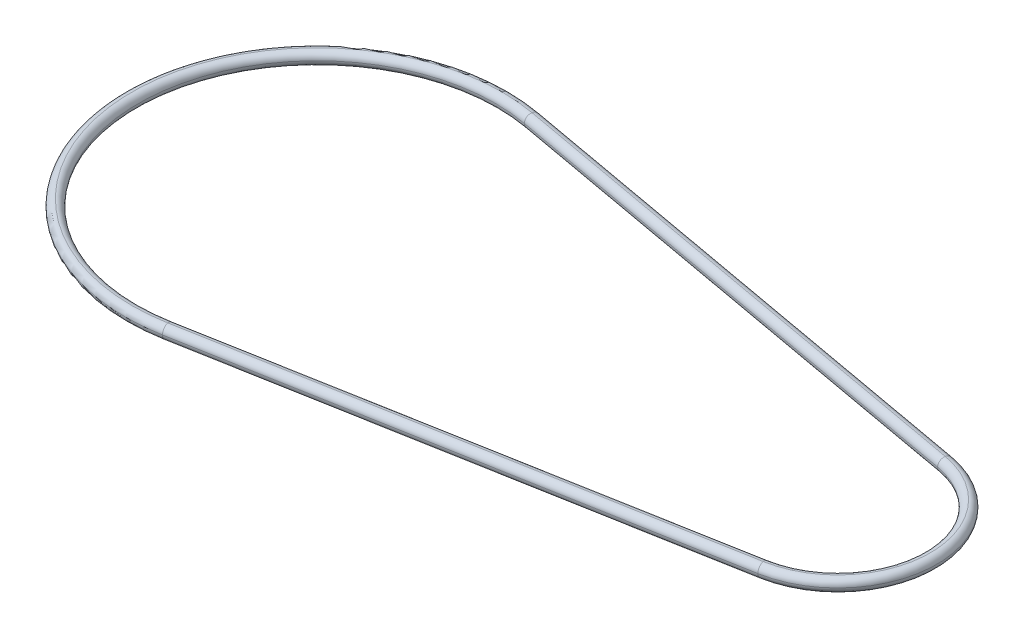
SolidWorks part; units mm, degrees
ref_plane "Plan de face" through (0, 0, 0) normal (0, 0, 1) x (1, 0, 0)
ref_plane "Plan de dessus" through (0, 0, 0) normal (0, 1, 0) x (1, 0, 0)
ref_plane "Plan de droite" through (0, 0, 0) normal (1, 0, 0) x (0, 0, -1)
sketch "Esquisse1" plane through (0, 0, 0) normal (0, 1, 0) x (1, 0, 0)
  line L0 (12.8807, 71.3466) -> (203.6624, 36.9034)
  line L1 (11.9924, 66.4261) -> (202.7741, 31.983)
  line L2 (11.9924, -66.4261) -> (202.7741, -31.983)
  line L3 (12.8807, -71.3466) -> (203.6624, -36.9034)
  arc A1 (202.7741, -31.983) -> (202.7741, 31.983) centre (197, 0) ccw
  arc A4 (203.6624, -36.9034) -> (203.6624, 36.9034) centre (197, 0) ccw
  arc A6 (12.8807, 71.3466) -> (12.8807, -71.3466) centre (0, 0) ccw
  arc A7 (11.9924, 66.4261) -> (11.9924, -66.4261) centre (0, 0) ccw
  dimension "D1" = 197
  dimension "D2" = 145
  dimension "D3" = 135
extrude "Extrusion1" add sketch "Esquisse1" along normal blind 5
fillet "Congé5" radius 2.5 24 edges at (234.5, 5, 0) (108.2716, 5, -54.125) (-67.5, 0, 0) (11.9924, 2.5, -66.4261) (107.3832, 0, 49.2046) (11.9924, 2.5, 66.4261) (229.5, 0, 0) (202.7741, 2.5, 31.983) (107.3832, 0, -49.2046) (202.7741, 2.5, -31.983) (-67.5, 5, 0) (107.3832, 5, 49.2046) (229.5, 5, 0) (107.3832, 5, -49.2046) (-72.5, 5, 0) (108.2716, 0, -54.125) (234.5, 0, 0) (108.2716, 0, 54.125) (-72.5, 0, 0) (108.2716, 5, 54.125) (12.8807, 2.5, -71.3466) (203.6624, 2.5, -36.9034) (203.6624, 2.5, 36.9034) (12.8807, 2.5, 71.3466)
